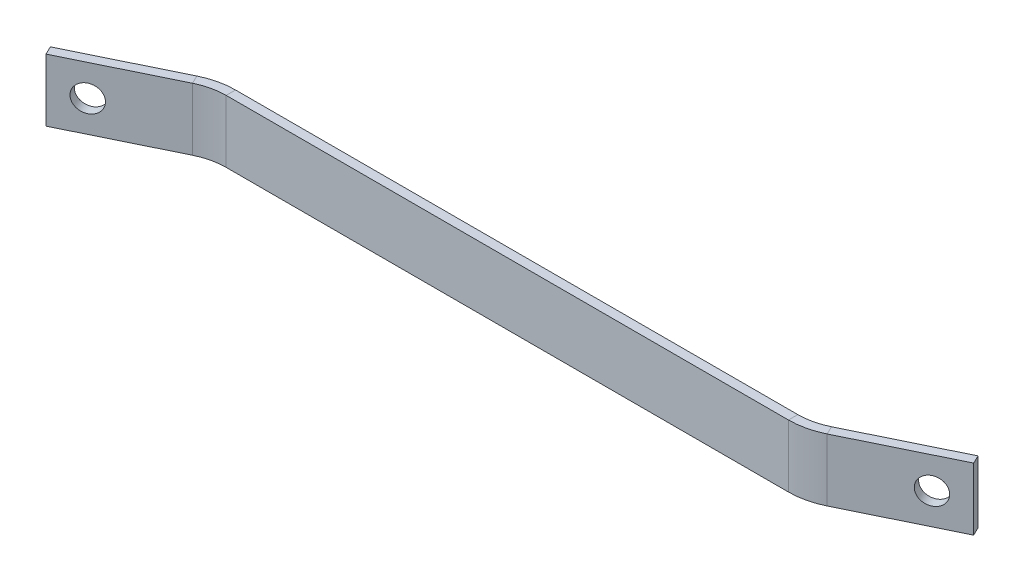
SolidWorks part; units mm, degrees
ref_plane "Plan1" through (0, 0, 0) normal (0, 0, 1) x (1, 0, 0)
ref_plane "Plan2" through (0, 0, 0) normal (0, 1, 0) x (1, 0, 0)
ref_plane "Plan3" through (0, 0, 0) normal (1, 0, 0) x (0, 0, -1)
sketch "Esquisse1" plane through (0, 0, 0) normal (0, 0, 1) x (1, 0, 0)
  line L1 (-10, 10) -> (260, 10)
  line L2 (-10, 10) -> (-10, -10)
  line L3 (-10, -10) -> (260, -10)
  line L4 (260, 10) -> (260, -10)
  circle A0 centre (0, 0) radius 4.25
  circle A1 centre (250, 0) radius 4.25
  dimension "D7" = 8.5
  dimension "D5" = 10
  dimension "D6" = 8.5
  dimension "D1" = 20
  dimension "D2" = 270
  dimension "D3" = 10
  dimension "D4" = 10
extrude "Extrusion1" add sketch "Esquisse1" along normal blind 3
sheet metal parameters "Tôlerie 1" parameters "D1"=20
flatten bends "Dépliage 1" parameters "D1"=0
sketch "Esquisse-Angle1" plane through (0, 0, 3) normal (0, 0, 1) x (1, 0, 0)
process bends "Pliage 1" parameters "D1"=20
sketch "Esquisse-Plate1" plane through (0, 0, 3) normal (0, 0, 1) x (1, 0, 0)
  line L0 (30, 10) -> (30, -10)
  line L1 (-10, 10) -> (260, 10) construction
  line L2 (-10, -10) -> (260, -10) construction
  line L3 (220, 10) -> (220, -10)
  line L4 (-10, 10) -> (-10, -10) construction
  line L5 (260, 10) -> (260, -10) construction
  point P12 (216, 0)
  dimension "D1" = 40
  dimension "D2" = 40
bend "Pli défini à plat1" bend radius 20 bend angle 26 parameters "D5"=1
bend "Pli défini à plat2" bend radius 20 bend angle 26 parameters "D5"=2
